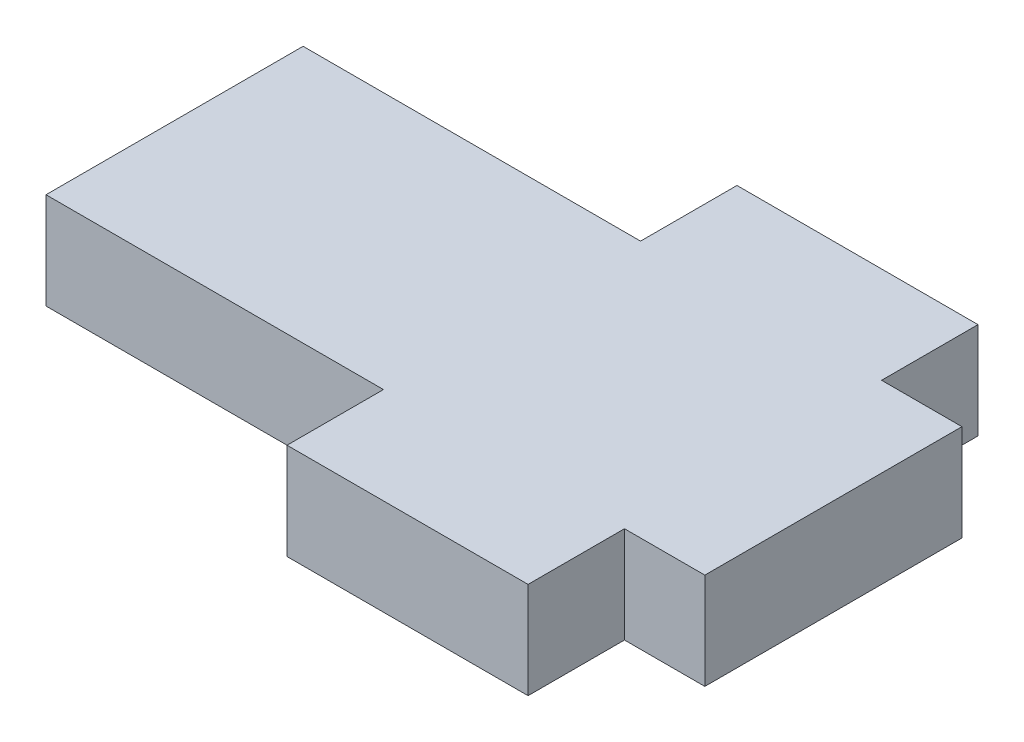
SolidWorks part; units mm, degrees
ref_plane "Ön Düzlem" through (0, 0, 0) normal (0, 0, 1) x (1, 0, 0)
ref_plane "Üst Düzlem" through (0, 0, 0) normal (0, 1, 0) x (1, 0, 0)
ref_plane "Sağ Düzlem" through (0, 0, 0) normal (1, 0, 0) x (0, 0, -1)
sketch "Çizim1" plane through (0, 0, 0) normal (0, 1, 0) x (1, 0, 0)
  line L0 (-7.5, 8) -> (-7.5, 14)
  line L1 (-12.5, 8) -> (-7.5, 8)
  line L3 (-12.5, -8) -> (-7.5, -8)
  line L4 (12.5, 8) -> (12.5, -8)
  line L5 (-12.5, 8) -> (12.5, -8) construction
  line L6 (-12.5, -8) -> (12.5, 8) construction
  line L8 (7.5, 14) -> (7.5, 8)
  line L9 (0, 0) -> (12.5, 0) construction
  line L10 (7.5, -14) -> (7.5, -8)
  line L11 (-7.5, -8) -> (-7.5, -14)
  line L12 (-7.5, -14) -> (7.5, -14)
  line L13 (7.5, 8) -> (12.5, 8)
  line L14 (7.5, -8) -> (12.5, -8)
  line L19 (-7.5, 14) -> (7.5, 14)
  line L20 (-12.5, 8) -> (-28.5, 8)
  line L21 (-28.5, 8) -> (-28.5, -8)
  line L22 (-28.5, -8) -> (-12.5, -8)
  point P0 (0, 0)
  dimension "D1" = 16
  dimension "D2" = 25
  dimension "D3" = 15
  dimension "D4" = 5
  dimension "D5" = 6
  dimension "D6" = 16
extrude "Yükseklik-Ekstrüzyon1" add sketch "Çizim1" along normal blind 6
